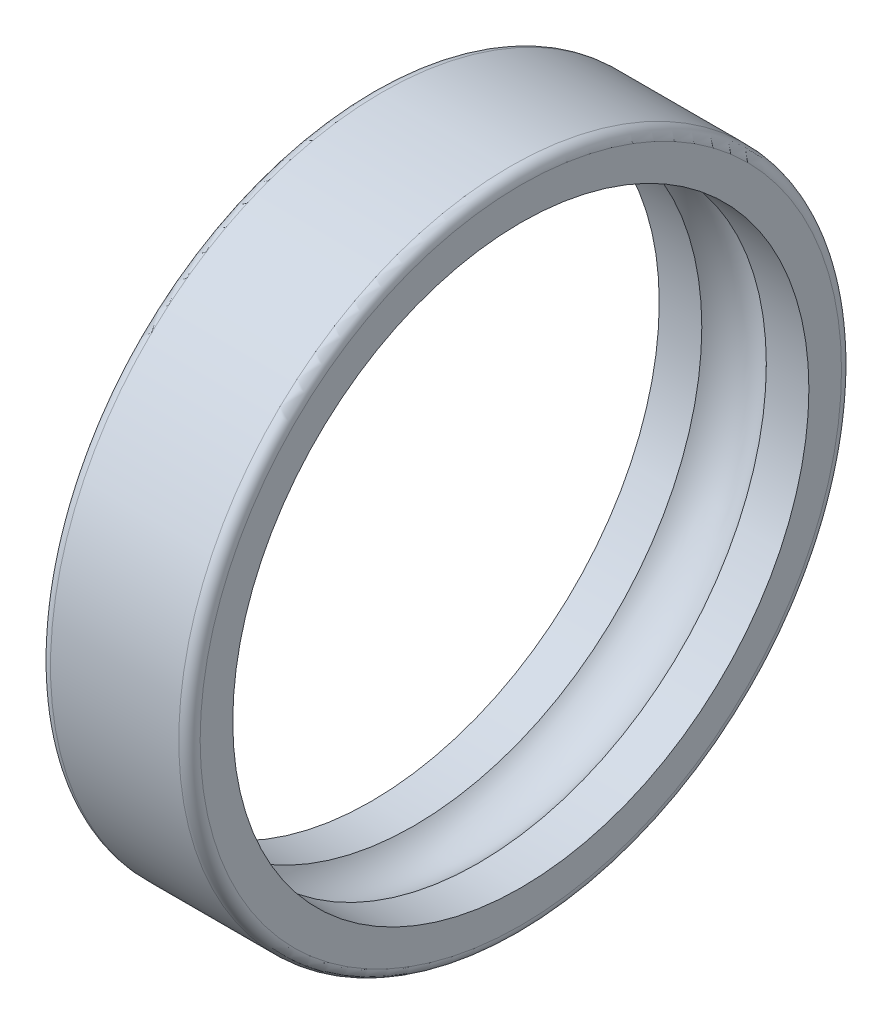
SolidWorks part; units mm, degrees
ref_plane "Plan de face" through (0, 0, 0) normal (0, 0, 1) x (1, 0, 0)
ref_plane "Plan de dessus" through (0, 0, 0) normal (0, 1, 0) x (1, 0, 0)
ref_plane "Plan de droite" through (0, 0, 0) normal (1, 0, 0) x (0, 0, -1)
sketch "Esquisse1" plane through (0, 0, 0) normal (0, 0, 1) x (1, 0, 0)
  line L0 (7, 31) -> (7, 17.5) construction
  line L1 (1, 31) -> (13, 31)
  line L2 (0, 30) -> (0, 18.5) construction
  line L3 (1, 17.5) -> (13, 17.5) construction
  line L4 (14, 30) -> (14, 18.5) construction
  line L5 (14, 26.95) -> (10.0187, 26.95)
  line L6 (14, 21.55) -> (0, 21.55) construction
  line L7 (0, 0) -> (14, 0) construction
  line L8 (14, 30) -> (14, 26.95)
  line L9 (0, 26.95) -> (0, 30)
  line L10 (3.9813, 26.95) -> (0, 26.95)
  arc A1 (0, 18.5) -> (1, 17.5) centre (1, 18.5) ccw construction
  arc A2 (1, 31) -> (0, 30) centre (1, 30) ccw
  arc A3 (14, 30) -> (13, 31) centre (13, 30) ccw
  arc A4 (13, 17.5) -> (14, 18.5) centre (13, 18.5) ccw construction
  arc A5 (10.0187, 26.95) -> (3.9813, 26.95) centre (7, 24.25) ccw
  dimension "D4" = 1
  dimension "D5" = 8.1
  dimension "D1" = 17.5
  dimension "D2" = 31
  dimension "D3" = 14
  dimension "D6" = 21.55
  dimension "D7" = 26.95
revolve "Révolution1" add sketch "Esquisse1" angle 360 about L7
